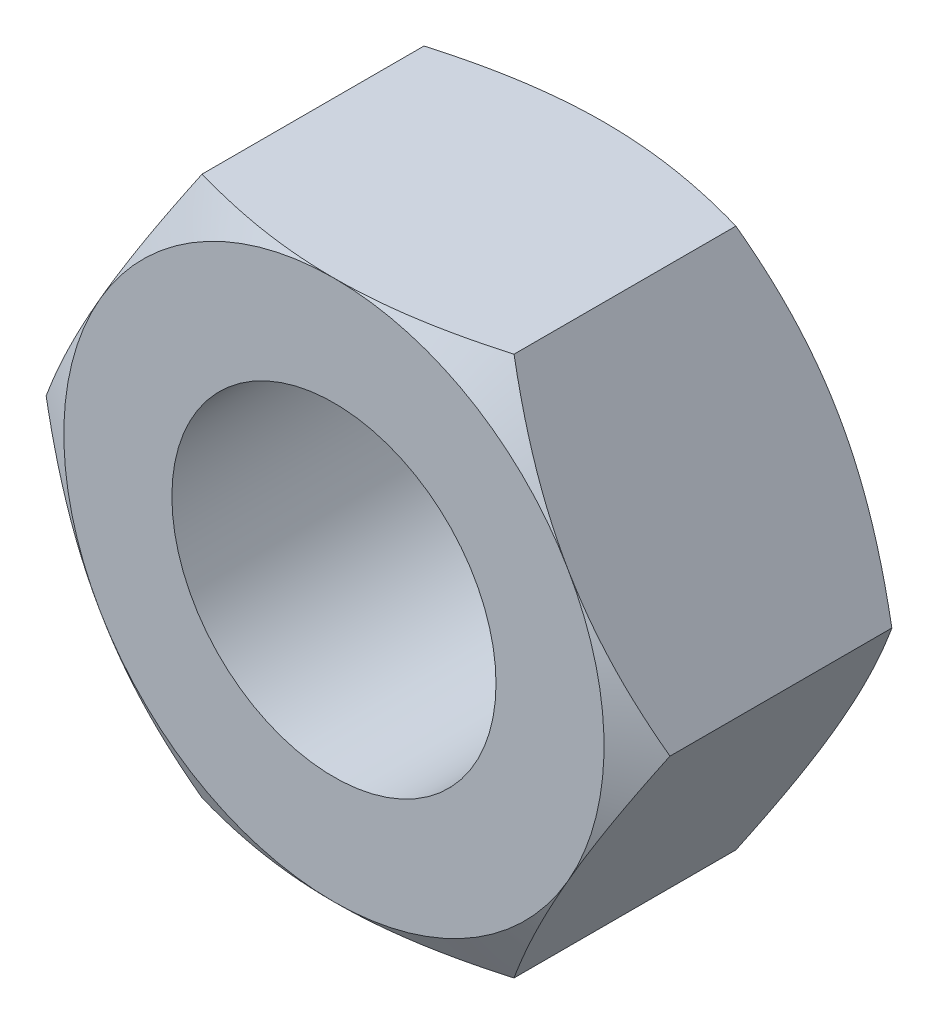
SolidWorks part; units mm, degrees
ref_plane "Plan1" through (0, 0, 0) normal (0, 0, 1) x (1, 0, 0)
ref_plane "Plan2" through (0, 0, 0) normal (0, 1, 0) x (1, 0, 0)
ref_plane "Plan3" through (0, 0, 0) normal (1, 0, 0) x (0, 0, -1)
sketch "Esquisse1" plane through (0, 0, 0) normal (0, 0, 1) x (1, 0, 0)
  line L0 (-2.8868, -5) -> (-5.7735, 0)
  line L1 (2.8868, -5) -> (-2.8868, -5)
  line L2 (5.7735, 0) -> (2.8868, -5)
  line L3 (-5.7735, 0) -> (-2.8868, 5)
  line L4 (-2.8868, 5) -> (2.8868, 5)
  line L5 (2.8868, 5) -> (5.7735, 0)
  circle A0 centre (0, 0) radius 3
  dimension "D6" = 6
  dimension "D1" = 5
  dimension "D2" = 5
  dimension "D3" = 5
  dimension "D4" = 5
  dimension "D5" = 5
extrude "Base-Extrusion" add sketch "Esquisse1" along normal mid plane 5
sketch "Esquisse2" plane through (0, 0, -2.5) normal (0, 0, -1) x (-1, 0, 0)
  line L0 (5.7735, 0) -> (2.8868, 5) construction
  circle A0 centre (0, 0) radius 6.7467
  circle A1 centre (0, 0) radius 5
extrude "Enlèv. mat.-Extru.1" cut sketch "Esquisse2" against normal blind 5 draft 60
sketch "Esquisse3" plane through (0, 0, 2.5) normal (0, 0, 1) x (1, 0, 0)
  line L0 (-5.7735, 0) -> (-2.8868, 5) construction
  circle A0 centre (0, 0) radius 5
  circle A1 centre (0, 0) radius 6.7374
extrude "Enlèv. mat.-Extru.2" cut sketch "Esquisse3" against normal blind 5 draft 60
